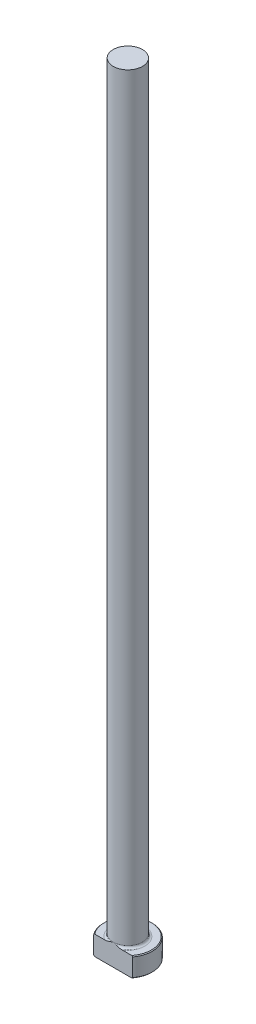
SolidWorks part; units mm, degrees
ref_plane "Front Plane" through (0, 0, 0) normal (0, 0, 1) x (1, 0, 0)
ref_plane "Top Plane" through (0, 0, 0) normal (0, 1, 0) x (1, 0, 0)
ref_plane "Right Plane" through (0, 0, 0) normal (1, 0, 0) x (0, 0, -1)
sketch "Sketch1" plane through (0, 0, 0) normal (0, 0, 1) x (1, 0, 0)
  line L0 (0, 259.9588) -> (0, -15.1925) construction
  line L1 (0, 0) -> (-7.9375, 0)
  line L2 (-7.9375, 0) -> (-7.9375, 6.35)
  line L3 (-7.9375, 6.35) -> (-4.7625, 6.35)
  line L4 (-4.7625, 6.35) -> (-4.7625, 254)
  line L5 (-4.7625, 254) -> (0, 254)
  line L6 (0, 254) -> (0, 0)
  dimension "L" = 254
  dimension "H" = 15.875
  dimension "T" = 6.35
  dimension "D" = 9.525
revolve "Revolve1" add sketch "Sketch1" angle 360 about L0
chamfer "Chamfer1" distance 0.254 angle 45 2 edges at (0, 6.35, 7.9375) (0, 0, 7.9375)
fillet "Fillet1" radius 0.762 1 edges at (0, 6.35, 4.7625)
sketch "Sketch2" plane through (0, 0, 0) normal (0, 1, 0) x (1, 0, 0)
  line L0 (-6.35, -4.7625) -> (6.35, -4.7625)
  circle A0 centre (0, 0) radius 7.9375 construction
  arc A1 (-6.35, -4.7625) -> (6.35, -4.7625) centre (0, 0) ccw
  circle A3 centre (0, 0) radius 4.7625 construction
  dimension "D1" = 0
extrude "Key" cut sketch "Sketch2" along normal through all
sketch "Pocket Sketch" plane through (0, 0, 0) normal (0, 0, 1) x (1, 0, 0)
  line L0 (-8.3344, 0) -> (-8.3344, 6.3754)
  line L1 (-8.3344, 6.3754) -> (-5.9214, 6.3754)
  line L2 (-5.1594, 7.1374) -> (-5.1594, 22.225)
  line L3 (-5.1594, 22.225) -> (0, 22.225)
  line L4 (0, 22.225) -> (0, 0)
  line L5 (0, 0) -> (-8.3344, 0)
  line L6 (0, 12.6104) -> (0, -2.4989) construction
  line L7 (-7.9375, 6.096) -> (-7.9375, 0.254) construction
  line L8 (7.6835, 6.35) -> (-7.6835, 6.35) construction
  line L9 (-4.7625, 254) -> (-4.7625, 7.112) construction
  line L10 (-5.9214, 6.3754) -> (-5.1594, 7.1374)
  point P3 (-5.1594, 6.3754)
  dimension "D1" = 16.6687
  dimension "D2" = 0.3969
  dimension "D3" = 0.0254
  dimension "D4" = 0.3969
  dimension "D5" = 10.3187
  dimension "D6" = 22.225
